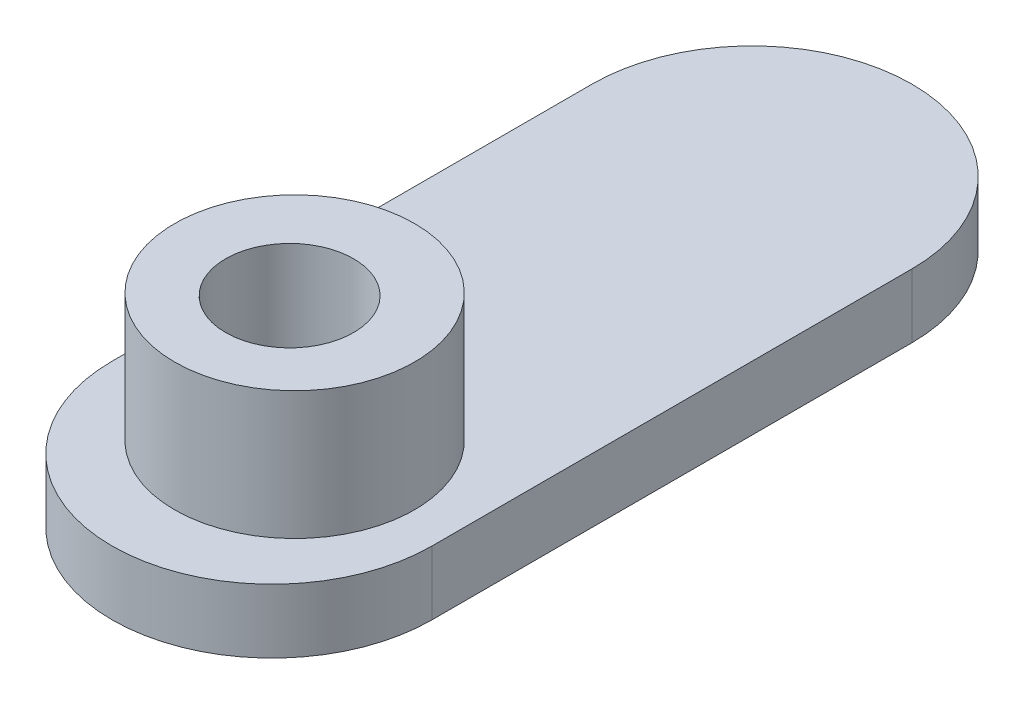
SolidWorks part; units mm, degrees
ref_plane "Front Plane" through (0, 0, 0) normal (0, 0, 1) x (1, 0, 0)
ref_plane "Top Plane" through (0, 0, 0) normal (0, 1, 0) x (1, 0, 0)
ref_plane "Right Plane" through (0, 0, 0) normal (1, 0, 0) x (0, 0, -1)
sketch "Sketch1" plane through (0, 0, 0) normal (0, 1, 0) x (1, 0, 0)
  line L2 (50, 0) -> (50, 150)
  line L4 (-50, 0) -> (-50, 150)
  arc A0 (-50, 0) -> (50, 0) centre (0, 0) ccw
  arc A1 (50, 150) -> (-50, 150) centre (0, 150) ccw
  dimension "D1" = 100
  dimension "D2" = 150
extrude "Base" add sketch "Sketch1" along normal blind 20
sketch "Sketch2" plane through (0, 20, 0) normal (0, 1, 0) x (1, 0, 0)
  line L0 (0, 150) -> (0, 7.0559) construction
  circle A0 centre (0, 7.0559) radius 37.5
  dimension "D1" = 75
  dimension "D2" = 142.9441
extrude "Boss" add sketch "Sketch2" along normal blind 40
sketch "Sketch3" plane through (0, 60, 0) normal (0, 1, 0) x (1, 0, 0)
  circle A0 centre (0, 5.5) radius 20
  dimension "D1" = 40
  dimension "D2" = 5.5
extrude "BossHole" cut sketch "Sketch3" against normal through all
sketch "Sketch4" plane through (0, 60, 0) normal (0, 1, 0) x (1, 0, 0)
  circle A0 centre (0, 7.0559) radius 25
  dimension "D1" = 50
extrude "Cut-Extrude2" [suppressed] cut sketch "Sketch4" against normal through all
